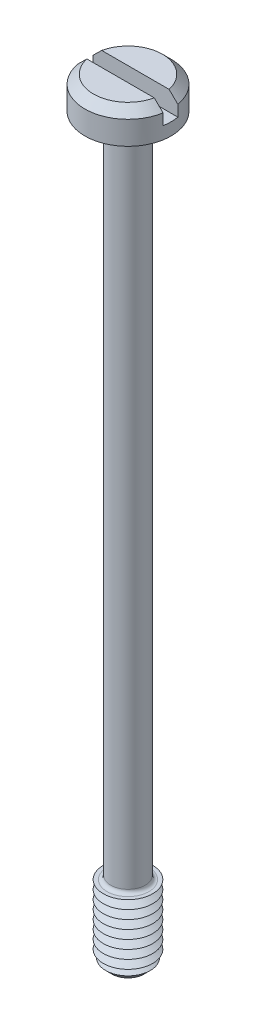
SolidWorks part; units mm, degrees
ref_plane "Front Plane" through (0, 0, 0) normal (0, 0, 1) x (1, 0, 0)
ref_plane "Top Plane" through (0, 0, 0) normal (0, 1, 0) x (1, 0, 0)
ref_plane "Right Plane" through (0, 0, 0) normal (1, 0, 0) x (0, 0, -1)
sketch "Sketch1" plane through (0, 0, 0) normal (0, 1, 0) x (1, 0, 0)
  circle A0 centre (0, 0) radius 3.5
  dimension "D1" = 7
extrude "Boss-Extrude1" add sketch "Sketch1" along normal blind 2.6
sketch "Sketch2" plane through (0, 0, 0) normal (0, -1, 0) x (1, 0, 0)
  circle A0 centre (0, 0) radius 1.4
  dimension "D1" = 2.8
extrude "Boss-Extrude2" add sketch "Sketch2" along normal blind 60
sketch "Sketch3" plane through (0, -60, 0) normal (0, -1, 0) x (1, 0, 0)
  circle A0 centre (0, 0) radius 2
  dimension "D1" = 4
extrude "Boss-Extrude3" add sketch "Sketch3" against normal blind 6
chamfer "Chamfer1" distance 0.7 angle 45 1 edges at (0, -60, -2)
sketch "Sketch4" plane through (0, 0, 0) normal (1, 0, 0) x (0, 0, -1)
  line L0 (0, -6.5871) -> (0, -12.0372) construction
sketch "Sketch5" plane through (0, 0, 0) normal (1, 0, 0) x (0, 0, -1)
  line L0 (-2, -54) -> (-1.3938, -54.35)
  line L1 (-1.3938, -54.35) -> (-2, -54.7)
  line L2 (-2, -54) -> (-2, -59.3) construction
  line L3 (-2, -54.7) -> (-2, -54)
  dimension "D1" = 0.7
revolve "Cut-Revolve1" cut sketch "Sketch5" angle 360 about L0
pattern_linear "LPattern1" count 8 spacing 0.7 along (0, -1, 0) of "Cut-Revolve1"
fillet "Fillet1" radius 0.3 2 edges at (0, -54, -1.4) (0, 0, -1.4)
chamfer "Chamfer2" distance 0.7 angle 45 1 edges at (0, 2.6, 3.5)
sketch "Sketch6" plane through (0, 2.6, 0) normal (0, 1, 0) x (1, 0, 0)
  line L1 (3.5, -0.6) -> (-3.5, -0.6)
  line L2 (3.5, -0.6) -> (3.5, 0.6)
  line L3 (3.5, 0.6) -> (-3.5, 0.6)
  line L4 (-3.5, -0.6) -> (-3.5, 0.6)
  line L5 (3.5, -0.6) -> (-3.5, 0.6) construction
  line L6 (3.5, 0.6) -> (-3.5, -0.6) construction
  circle A0 centre (0, 0) radius 3.5 construction
  point P0 (0, 0)
  dimension "D1" = 1.2
extrude "Cut-Extrude1" cut sketch "Sketch6" against normal blind 1.6
